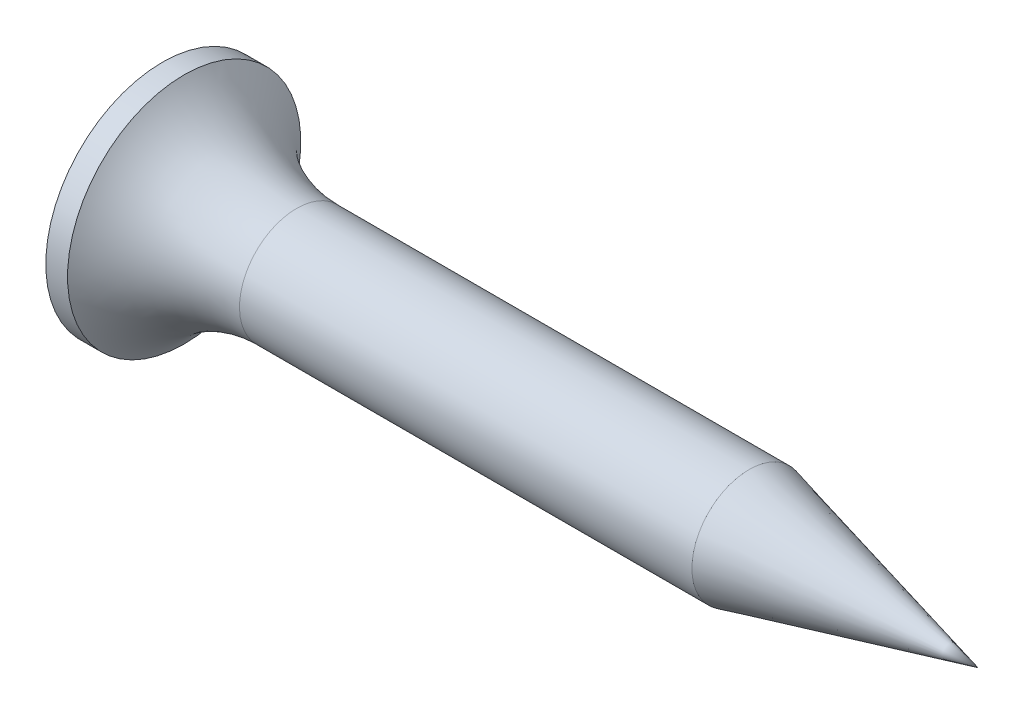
SolidWorks part; units mm, degrees
ref_plane "Front" through (0, 0, 0) normal (0, 0, 1) x (1, 0, 0)
ref_plane "Top" through (0, 0, 0) normal (0, 1, 0) x (1, 0, 0)
ref_plane "Right" through (0, 0, 0) normal (1, 0, 0) x (0, 0, -1)
sketch "Sketch1" plane through (0, 0, 0) normal (0, 0, 1) x (1, 0, 0)
  line L0 (30, 0) -> (21.5774, 2.1)
  line L1 (21.5774, 2.1) -> (4.9357, 2.1)
  line L2 (30, 0) -> (-110.3899, 0) construction
  line L3 (0.8, 4.29) -> (0, 4.29)
  line L4 (0, 4.29) -> (0, 0)
  line L5 (30, 0) -> (0, 0)
  arc A0 (4.9357, 2.1) -> (0.8, 4.29) centre (4.9357, 7.1) cw
  dimension "r" = 5
  dimension "D1" = 14
  dimension "d" = 4.2
  dimension "dk" = 8.58
  dimension "c" = 0.8
  dimension "l" = 30
revolve "Base" add sketch "Sketch1" angle 360 about L2
sketch "Sketch3" plane through (0, 0, 0) normal (1, 0, 0) x (0, 0, -1)
  line L0 (0, 5.1262) -> (0, -0.6806) construction
  line L1 (-3.8942, 0) -> (0.672, 0) construction
  line L2 (0.5, 2.5) -> (-0.5, 2.5)
  line L3 (-0.5, 2.5) -> (-0.5, 0.5)
  line L4 (-0.5, 0.5) -> (-2.5, 0.5)
  line L5 (-2.5, 0.5) -> (-2.5, -0.5)
  line L6 (-0.5, -0.5) -> (-2.5, -0.5)
  line L7 (-0.5, -2.5) -> (-0.5, -0.5)
  line L8 (0.5, -2.5) -> (-0.5, -2.5)
  line L9 (0.5, -2.5) -> (0.5, -0.5)
  line L10 (0.5, -0.5) -> (2.5, -0.5)
  line L11 (2.5, 0.5) -> (2.5, -0.5)
  line L12 (0.5, 0.5) -> (2.5, 0.5)
  line L13 (0.5, 2.5) -> (0.5, 0.5)
  point P5 (2.5, 0)
  point P11 (-2.5, 0)
  point P15 (0, -2.5)
  point P20 (0, 2.5)
  dimension "m" = 5
  dimension "D2" = 1
extrude "Cut-Extrude1" cut sketch "Sketch3" along normal blind 2.0314
draft "Draft1" type of draft neutral plane draft angle 30 faces to draft 4 parameters "D1"=30
sketch "Sketch4" plane through (0, 0, 0) normal (0, 0, 1) x (1, 0, 0)
  line L0 (4.9357, 2.35) -> (5.1857, 2.35)
  line L1 (5.1857, 2.35) -> (5.1857, 2.1)
  line L2 (5.1857, 2.1) -> (5.0607, 1.8835)
  line L3 (5.0607, 1.8835) -> (4.9357, 2.1)
  line L4 (4.9357, 2.1) -> (4.9357, 2.35)
  line L5 (0, 0) -> (4.4852, 0) construction
  line L6 (0, 4.29) -> (0, -4.29) construction
  line L7 (4.9357, 2.1) -> (4.9357, -2.1) construction
  dimension "D1" = 4.2
  dimension "D2" = 0.25
revolve "Cut-Revolve10" [suppressed] cut sketch "Sketch4" angle 360 about L5
pattern_linear "LPattern10" [suppressed] count 81 spacing 0.3 along (-1, 0, 0)
equation "\"D2@Sketch3\" = \"m@Sketch3\" / 5"
equation "\"D2@ThreadCosmetic1\" = \"d@Sketch1\" - 0.5"
equation "\"D1@Sketch4\" = \"d@Sketch1\""
equation "\"D2@Sketch4\" = (  \"d@Sketch1\" - \"D2@ThreadCosmetic1\" )  / 2"
equation "\"D3@LPattern10\" = \"D2@Sketch4\" * 1.2"
equation "\"D1@LPattern10\" = (  \"l@Sketch1\" - \"c@Sketch1\" - \"r@Sketch1\" )  / \"D3@LPattern10\""
